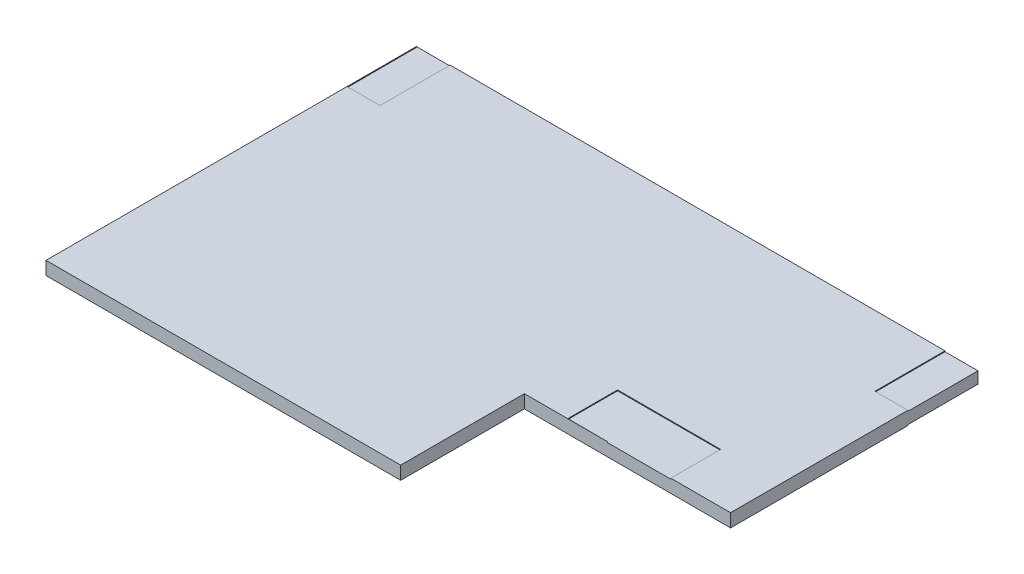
SolidWorks part; units mm, degrees
ref_plane "Plan de face" through (0, 0, 0) normal (0, 0, 1) x (1, 0, 0)
ref_plane "Plan de dessus" through (0, 0, 0) normal (0, 1, 0) x (1, 0, 0)
ref_plane "Plan de droite" through (0, 0, 0) normal (1, 0, 0) x (0, 0, -1)
sketch "Esquisse1" plane through (0, 0, 0) normal (0, 0, 1) x (1, 0, 0)
  line L0 (23.0111, 70.8023) -> (23.0111, 72.4023)
  line L1 (23.0111, 70.8023) -> (91.0111, 70.8023)
  line L2 (23.0111, 72.4023) -> (91.0111, 72.4023)
  line L3 (91.0111, 70.8023) -> (91.0111, 72.4023)
  line L4 (22.5111, 70.8023) -> (102.0199, 70.8023) construction
  line L5 (22.5111, 72.4023) -> (102.0199, 72.4023) construction
  dimension "D1" = 1.6
extrude "Extrusion1" add sketch "Esquisse1" along normal blind 45
sketch "Esquisse2" plane through (0, 72.4023, 0) normal (0, 1, 0) x (-1, 0, 0)
  line L0 (-91.0111, 64) -> (-66.0111, 64)
  line L2 (-91.0111, 64) -> (-91.0111, 30)
  line L3 (-91.0111, 30) -> (-66.0111, 30)
  line L4 (-66.0111, 64) -> (-66.0111, 30)
extrude "Enlèv. mat.-Extru.1" cut sketch "Esquisse2" against normal blind 2
sketch "Esquisse4" plane through (0, 72.4023, 0) normal (0, 1, 0) x (-1, 0, 0)
  line L0 (-91.0111, 8.5) -> (-87.0111, 8.5)
  line L1 (-92.0112, 7.5) -> (-88.0111, 7.5) construction
  line L2 (-87.0111, 8.5) -> (-87.0111, 0)
  line L3 (-88.0111, -1.6276) -> (-88.0111, 7.5) construction
  line L4 (-27.0111, 8.5) -> (-27.0111, 0)
  line L5 (-27.0111, 8.5) -> (-23.0298, 8.5)
  line L6 (-26.0111, 7.5) -> (-22.0109, 7.5) construction
  line L7 (-26.0111, -1.5843) -> (-26.0111, 7.5) construction
  line L8 (-83.7611, 23.9526) -> (-71.2611, 23.9526)
  line L9 (-71.2611, 29.9478) -> (-71.2611, 23.9526)
  line L10 (-83.7611, 30.0824) -> (-83.7611, 23.9526)
  line L11 (-72.2611, 24.9526) -> (-82.7611, 24.9526) construction
  line L12 (-72.2611, 45.5) -> (-72.2611, 24.9526) construction
  line L13 (-82.7611, 45.5) -> (-82.7611, 24.9526) construction
  line L14 (-91.0111, 8.5) -> (-91.0111, 0)
  line L19 (-91.0111, 0) -> (-87.0111, 0)
  line L20 (-83.7611, 30.0824) -> (-71.2611, 29.9478)
  line L21 (-23.0298, 8.5) -> (-23.0111, 0)
  line L22 (-23.0111, 0) -> (-27.0111, 0)
  dimension "D1" = 1
  dimension "D2" = 1
  dimension "D3" = 1
  dimension "D4" = 1
  dimension "D5" = 1
  dimension "D6" = 1
  dimension "D7" = 1
sketch "Esquisse5" plane through (0, 70.8023, 0) normal (0, -1, 0) x (1, 0, 0)
  line L3 (27.0111, 8.5) -> (27.0111, 0) construction
  line L4 (27.0111, 8.5) -> (23.0298, 8.5) construction
  line L5 (91.0111, 8.5) -> (87.0111, 8.5) construction
  line L6 (87.0111, 8.5) -> (87.0111, 0) construction
  line L7 (23.0298, 8.5) -> (23.0111, 0)
  line L8 (23.0111, 0) -> (27.0111, 0)
  line L9 (87.0111, 0) -> (91.0111, 0)
  line L10 (27.0111, 8.5) -> (27.0111, 0)
  line L11 (27.0111, 8.5) -> (23.0298, 8.5)
  line L12 (91.0111, 8.5) -> (87.0111, 8.5)
  line L13 (87.0111, 8.5) -> (87.0111, 0)
  line L14 (91.0111, 0) -> (91.0111, 8.5)
extrude "Enlèv. mat.-Extru.2" cut sketch "Esquisse4" against normal blind 0.1
extrude "Enlèv. mat.-Extru.3" cut sketch "Esquisse5" against normal blind 0.1
sketch "Esquisse6" plane through (0, 72.4023, 0) normal (0, 1, 0) x (-1, 0, 0)
  line L1 (-64.939, 26.2597) -> (-37.939, 26.2597)
  line L2 (-64.939, 26.2597) -> (-64.939, 12.2597)
  line L3 (-64.939, 12.2597) -> (-37.939, 12.2597)
  line L4 (-37.939, 26.2597) -> (-37.939, 12.2597)
  dimension "D1" = 27
  dimension "D2" = 14
extrude "Enlèv. mat.-Extru.5" [suppressed] cut sketch "Esquisse6" against normal blind 0.1
